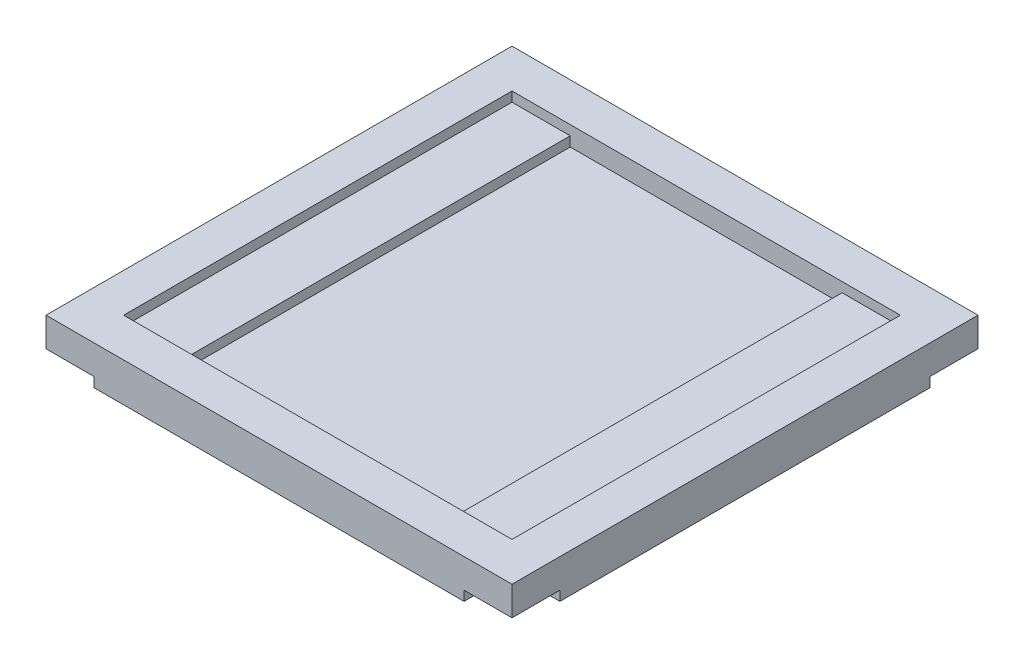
SolidWorks part; units mm, degrees
ref_plane "Front Plane" through (0, 0, 0) normal (0, 0, 1) x (1, 0, 0)
ref_plane "Top Plane" through (0, 0, 0) normal (0, 1, 0) x (1, 0, 0)
ref_plane "Right Plane" through (0, 0, 0) normal (1, 0, 0) x (0, 0, -1)
sketch "Sketch1" plane through (0, 0, 0) normal (0, 1, 0) x (1, 0, 0)
  line L0 (-10, -10) -> (-10, 110)
  line L5 (-10, 110) -> (110, 110)
  line L6 (110, -10) -> (110, 110)
  line L7 (-10, -10) -> (110, -10)
extrude "Boss-Extrude1" add sketch "Sketch1" along normal blind 10
sketch "Sketch3" plane through (0, 0, 0) normal (0, -1, 0) x (1, 0, 0)
  line L0 (110, 10) -> (110, -2.34)
  line L1 (-10, 10) -> (2.34, 10)
  line L2 (-10, 10) -> (-10, -2.34)
  line L3 (-10, -2.34) -> (2.34, -2.34)
  line L4 (2.34, 10) -> (2.34, -2.34)
  line L5 (97.66, 10) -> (110, 10)
  line L6 (97.66, -2.34) -> (110, -2.34)
  line L7 (97.66, 10) -> (97.66, -2.34)
  line L8 (110, -97.66) -> (110, -110)
  line L9 (97.66, -97.66) -> (110, -97.66)
  line L10 (97.66, -110) -> (110, -110)
  line L11 (97.66, -97.66) -> (97.66, -110)
  line L12 (-10, -97.66) -> (-10, -110)
  line L13 (2.34, -97.66) -> (2.34, -110)
  line L14 (-10, -97.66) -> (2.34, -97.66)
  line L15 (-10, -110) -> (2.34, -110)
  dimension "D1" = 12.34
extrude "Cut-Extrude1" cut sketch "Sketch3" against normal blind 2.5
sketch "Sketch4" plane through (0, 10, 0) normal (0, 1, 0) x (1, 0, 0)
  line L1 (0, 100) -> (100, 100)
  line L2 (0, 100) -> (0, 0)
  line L3 (0, 0) -> (100, 0)
  line L4 (100, 100) -> (100, 0)
  point P4 (0, 0)
  dimension "D1" = 100
  dimension "D2" = 100
extrude "Cut-Extrude2" cut sketch "Sketch4" against normal blind 2.5
sketch "Sketch5" plane through (0, 7.5, 0) normal (0, 1, 0) x (1, 0, 0)
  line L0 (100, 100) -> (0, 100) construction
  line L1 (15, 100) -> (85, 100)
  line L2 (15, 100) -> (15, 0)
  line L3 (15, 0) -> (85, 0)
  line L4 (85, 100) -> (85, 0)
  line L5 (0, 0) -> (100, 0) construction
  line L6 (0, 100) -> (0, 0) construction
  line L7 (100, 0) -> (100, 100) construction
  dimension "D1" = 15
  dimension "D2" = 15
extrude "Cut-Extrude3" cut sketch "Sketch5" against normal blind 2.5
